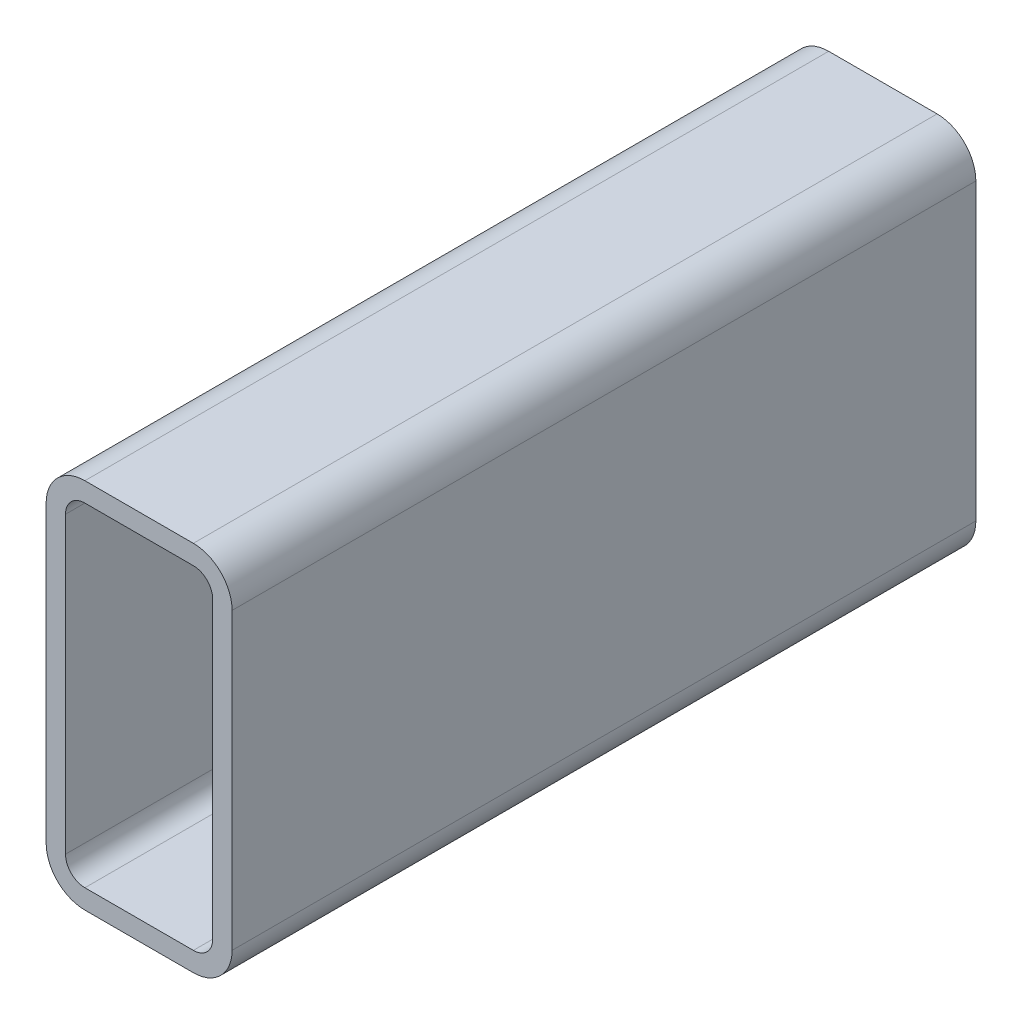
SolidWorks part; units mm, degrees
ref_plane "Front Plane" through (0, 0, 0) normal (0, 0, 1) x (1, 0, 0)
ref_plane "Top Plane" through (0, 0, 0) normal (0, 1, 0) x (1, 0, 0)
ref_plane "Right Plane" through (0, 0, 0) normal (1, 0, 0) x (0, 0, -1)
sketch "Sketch1" plane through (0, 0, 0) normal (0, 0, 1) x (1, 0, 0)
sketch_block_instance "HSS6x3x0.3125-1"
sketch_block "HSS6x3x0.3125"
extrude "Boss-Extrude1" add sketch "Sketch1" along normal blind 304.8
